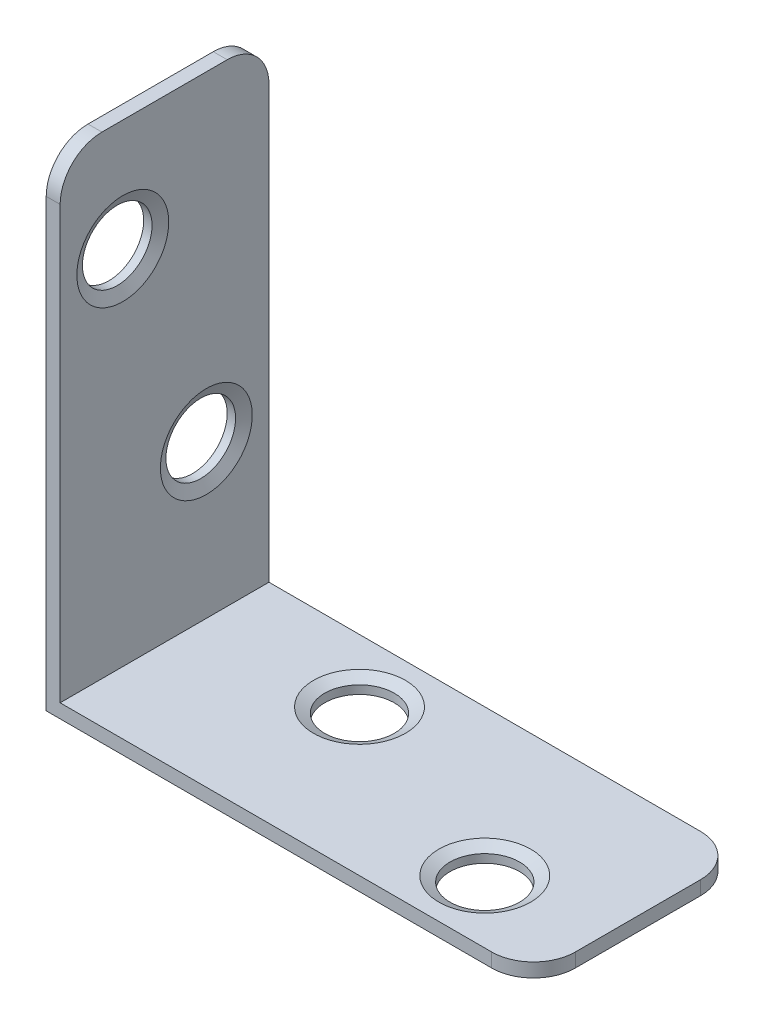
SolidWorks part; units mm, degrees
ref_plane "Alzado" through (0, 0, 0) normal (0, 0, 1) x (1, 0, 0)
ref_plane "Planta" through (0, 0, 0) normal (0, 1, 0) x (1, 0, 0)
ref_plane "Vista lateral" through (0, 0, 0) normal (1, 0, 0) x (0, 0, -1)
sketch "Croquis1" plane through (0, 0, 0) normal (0, 0, 1) x (1, 0, 0)
  line L0 (0, 0) -> (0, 35)
  line L1 (0, 35) -> (1, 35)
  line L2 (1, 35) -> (1, 1)
  line L3 (1, 1) -> (35, 1)
  line L4 (35, 1) -> (35, 0)
  line L5 (35, 0) -> (0, 0)
  dimension "D1" = 35
  dimension "D2" = 35
  dimension "D3" = 1
extrude "Saliente-Extruir1" add sketch "Croquis1" along normal mid plane 15
fillet "Redondeo1" radius 3 4 edges at (0.5, 35, -7.5) (35, 0.5, -7.5) (0.5, 35, 7.5) (35, 0.5, 7.5)
sketch "Croquis2" plane through (1, 0, 0) normal (1, 0, 0) x (0, 0, -1)
  line L0 (0, 35) -> (0, 18.4342) construction
  line L2 (-4.5, 35) -> (4.5, 35) construction
  circle A0 centre (-3, 27) radius 2.5
  circle A1 centre (3, 12) radius 2.5
  dimension "D1" = 3
  dimension "D3" = 15
  dimension "D4" = 8
  dimension "D5" = 5
  dimension "D2" = 3
extrude "Cortar-Extruir1" cut sketch "Croquis2" against normal through all
ref_plane "Plano1" through (0, 0, 0) normal (-0.7071, 0.7071, 0) x (0.7071, 0.7071, 0)
mirror "Simetría1" about plane through (0, 0, 0) normal (-0.7071, 0.7071, 0) of "Cortar-Extruir1"
chamfer "Chaflán1" distance 0.8 distance2 0.4 2 edges at (1, 29.5, 3) (1, 14.5, -3)
chamfer "Chaflán2" distance 0.4 distance2 0.8 2 edges at (14.5, 1, -3) (29.5, 1, 3)
